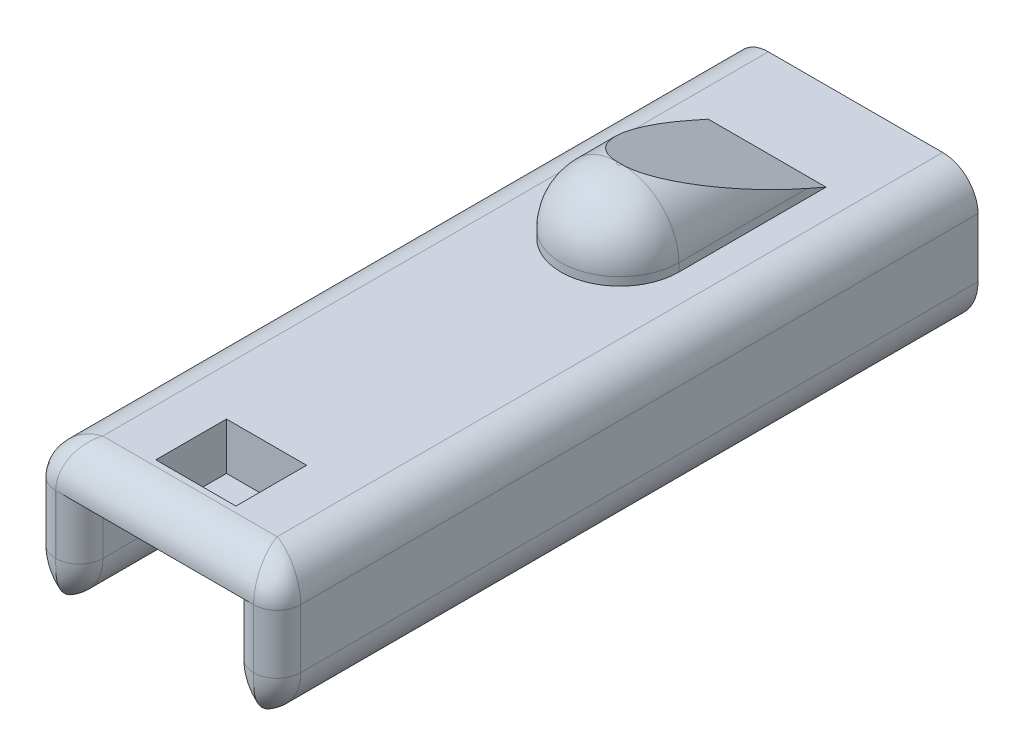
SolidWorks part; units mm, degrees
ref_plane "Front Plane" through (0, 0, 0) normal (0, 0, 1) x (1, 0, 0)
ref_plane "Top Plane" through (0, 0, 0) normal (0, 1, 0) x (1, 0, 0)
ref_plane "Right Plane" through (0, 0, 0) normal (1, 0, 0) x (0, 0, -1)
sketch "Sketch1" plane through (0, 0, 0) normal (0, 0, 1) x (1, 0, 0)
  line L1 (-132.08, 152.4) -> (132.08, 152.4)
  line L2 (-132.08, 152.4) -> (-132.08, 0)
  line L3 (-132.08, 0) -> (132.08, 0)
  line L4 (132.08, 152.4) -> (132.08, 0)
  point P4 (0, 0)
  dimension "D1" = 152.4
  dimension "D2" = 264.16
extrude "Boss-Extrude1" add sketch "Sketch1" along normal blind 755.65
sketch "Sketch2" plane through (0, 0, 755.65) normal (0, 0, 1) x (1, 0, 0)
  line L0 (-132.08, 0) -> (132.08, 0) construction
  line L1 (-81.2226, 0) -> (81.28, 0)
  line L2 (-81.2226, 0) -> (-81.2226, 88.9)
  line L3 (-81.2226, 88.9) -> (81.28, 88.9)
  line L4 (81.28, 0) -> (81.28, 88.9)
  line L5 (-132.08, 152.4) -> (-132.08, 0) construction
  line L6 (132.08, 0) -> (132.08, 152.4) construction
  dimension "D1" = 88.9
  dimension "D2" = 50.8574
  dimension "D3" = 50.8
extrude "Cut-Extrude1" cut sketch "Sketch2" against normal through all
fillet "Fillet1" radius 50.8 4 edges at (132.08, 0, 377.825) (81.28, 0, 377.825) (-81.2226, 0, 377.825) (-132.08, 0, 377.825)
fillet "Fillet2" radius 25.4 8 edges at (125.2741, 25.4, 755.65) (-81.2226, 69.85, 755.65) (-132.08, 101.6, 755.65) (132.08, 101.6, 755.65) (-88.0368, 25.3856, 755.65) (-125.2658, 25.3856, 755.65) (81.28, 69.85, 755.65) (88.0859, 25.4, 755.65)
fillet "Fillet3" radius 38.1 5 edges at (132.08, 152.4, 365.125) (124.6405, 152.4, 748.2105) (-132.08, 152.4, 365.125) (-124.6405, 152.4, 748.2105) (0, 152.4, 755.65)
sketch "Sketch3" plane through (0, 152.4, 0) normal (0, 1, 0) x (1, 0, 0)
  line L0 (93.98, 0) -> (-93.98, 0) construction
  line L1 (63.5, -254) -> (-63.5, -254)
  circle A0 centre (0, -254) radius 63.5
  dimension "D1" = 127
  dimension "D2" = 254
ref_plane "Plane1" through (0, 0, 0) normal (1, 0, 0) x (0, 0, -1)
extrude "Boss-Extrude4" add sketch "Sketch3" along normal blind 69.85 contours L1 A0
sketch "Sketch6" plane through (0, 0, 0) normal (1, 0, 0) x (0, 0, -1)
  line L0 (-254, 222.25) -> (-95.25, 152.4)
  line L1 (-717.55, 152.4) -> (0, 152.4) construction
  line L2 (-95.25, 152.4) -> (-254, 152.4)
  line L3 (-254, 152.4) -> (-254, 222.25)
  dimension "D1" = 95.25
extrude "Boss-Extrude5" add sketch "Sketch6" along normal mid plane 127
fillet "Fillet5" radius 60.96 1 edges at (0, 222.25, 317.5)
sketch "Sketch9" plane through (0, 0, 0) normal (0, 0, -1) x (-1, 0, 0)
  line L0 (-81.28, 88.9) -> (81.2226, 88.9) construction
  line L1 (-81.28, 119.38) -> (81.2226, 119.38)
  line L2 (-81.28, 119.38) -> (-81.28, 88.9)
  line L3 (-81.28, 88.9) -> (81.2226, 88.9)
  line L4 (81.2226, 119.38) -> (81.2226, 88.9)
  dimension "D1" = 30.48
extrude "Cut-Extrude2" cut sketch "Sketch9" against normal blind 25.4
sketch "Sketch10" plane through (0, 0, 25.4) normal (0, 0, -1) x (-1, 0, 0)
  line L1 (81.2226, 88.9) -> (81.2226, 119.38) construction
  line L2 (-81.28, 88.9) -> (81.2226, 88.9) construction
  circle A0 centre (-0.0287, 104.14) radius 7.62
  point P8 (81.2226, 104.14)
  point P10 (-0.0287, 88.9)
  dimension "D1" = 15.24
extrude "Cut-Extrude3" cut sketch "Sketch10" against normal blind 12.7
sketch "Sketch11" plane through (0, 152.4, 0) normal (0, 1, 0) x (1, 0, 0)
  line L1 (-43.18, -635) -> (43.18, -635)
  line L2 (-43.18, -635) -> (-43.18, -711.2)
  line L3 (-43.18, -711.2) -> (43.18, -711.2)
  line L4 (43.18, -635) -> (43.18, -711.2)
  line L6 (93.98, -717.55) -> (93.98, 0) construction
  line L7 (-93.98, 0) -> (-93.98, -717.55) construction
  line L8 (-93.98, -717.55) -> (93.98, -717.55) construction
  dimension "D1" = 76.2
  dimension "D2" = 50.8
  dimension "D3" = 50.8
  dimension "D4" = 6.35
extrude "Cut-Extrude4" cut sketch "Sketch11" against normal blind 50.8
chamfer "Chamfer1" distance 25.4 angle 45 1 edges at (0.0287, 88.9, 755.65)
sketch "Sketch12" plane through (0, -320.675, 320.675) normal (0, -0.7071, 0.7071) x (1, 0, 0)
  line L0 (19.5721, 615.1475) -> (19.5721, 579.2265) construction
  line L1 (106.68, 615.1475) -> (-106.6226, 615.1475) construction
  line L2 (81.28, 579.2265) -> (-81.2226, 579.2265) construction
  line L3 (132.08, 80.8223) -> (132.08, 597.187) construction
  circle A0 centre (0.0287, 597.187) radius 12.7
  point P2 (0, 0)
  point P3 (19.5721, 597.187)
  point P12 (0.0287, 615.1475)
  dimension "D2" = 25.4
  dimension "D1" = 112.5079
extrude "Cut-Extrude5" cut sketch "Sketch12" against normal blind 2.54
